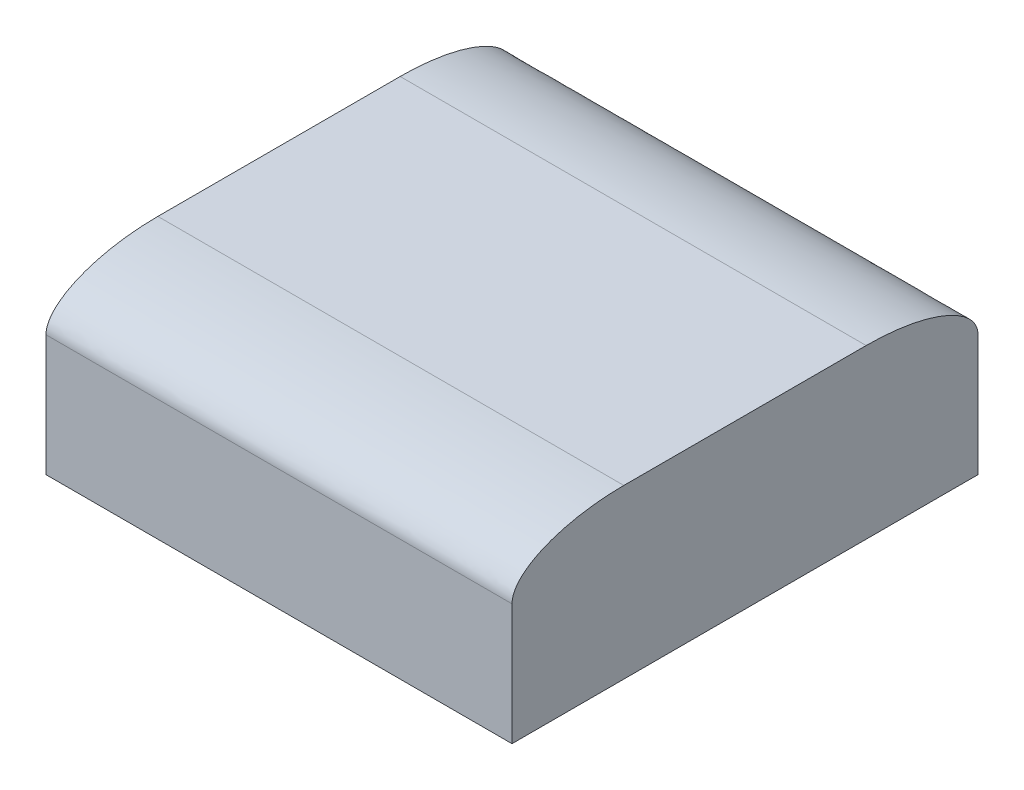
SolidWorks part; units mm, degrees
ref_plane "Front Plane" through (0, 0, 0) normal (0, 0, 1) x (1, 0, 0)
ref_plane "Top Plane" through (0, 0, 0) normal (0, 1, 0) x (1, 0, 0)
ref_plane "Right Plane" through (0, 0, 0) normal (1, 0, 0) x (0, 0, -1)
sketch "Sketch1" plane through (0, 0, 0) normal (0, 1, 0) x (1, 0, 0)
  line L1 (0, 0) -> (50, 0)
  line L2 (0, 0) -> (0, 50)
  line L3 (0, 50) -> (50, 50)
  line L4 (50, 0) -> (50, 50)
  dimension "D1" = 50
extrude "Base" add sketch "Sketch1" along normal blind 18
sketch "Sketch2" plane through (0, 18, 0) normal (0, 1, 0) x (-1, 0, 0)
  line L1 (0, 0) -> (-50, 0) construction
  circle A0 centre (-25, -6) radius 4
  point P6 (-25, 0)
  dimension "D1" = 8
  dimension "D2" = 6
extrude "Hole" cut sketch "Sketch2" against normal blind 8
sketch "Sketch3" plane through (0, 18, 0) normal (0, 1, 0) x (-1, 0, 0)
  line L0 (-25, -42) -> (-25, -47) construction
  line L1 (-19, -47) -> (-31, -47)
  line L2 (-19, -47) -> (-19, -42)
  line L3 (-19, -42) -> (-31, -42)
  line L4 (-31, -47) -> (-31, -42)
  line L6 (-50, -50) -> (0, -50) construction
  point P9 (-25, -50)
  dimension "D1" = 12
  dimension "D2" = 5
  dimension "D3" = 8
extrude "Boss" add sketch "Sketch3" along normal blind 8
fillet "Fillet1" radius 5 2 edges at (25, 18, -50) (25, 18, 0)
